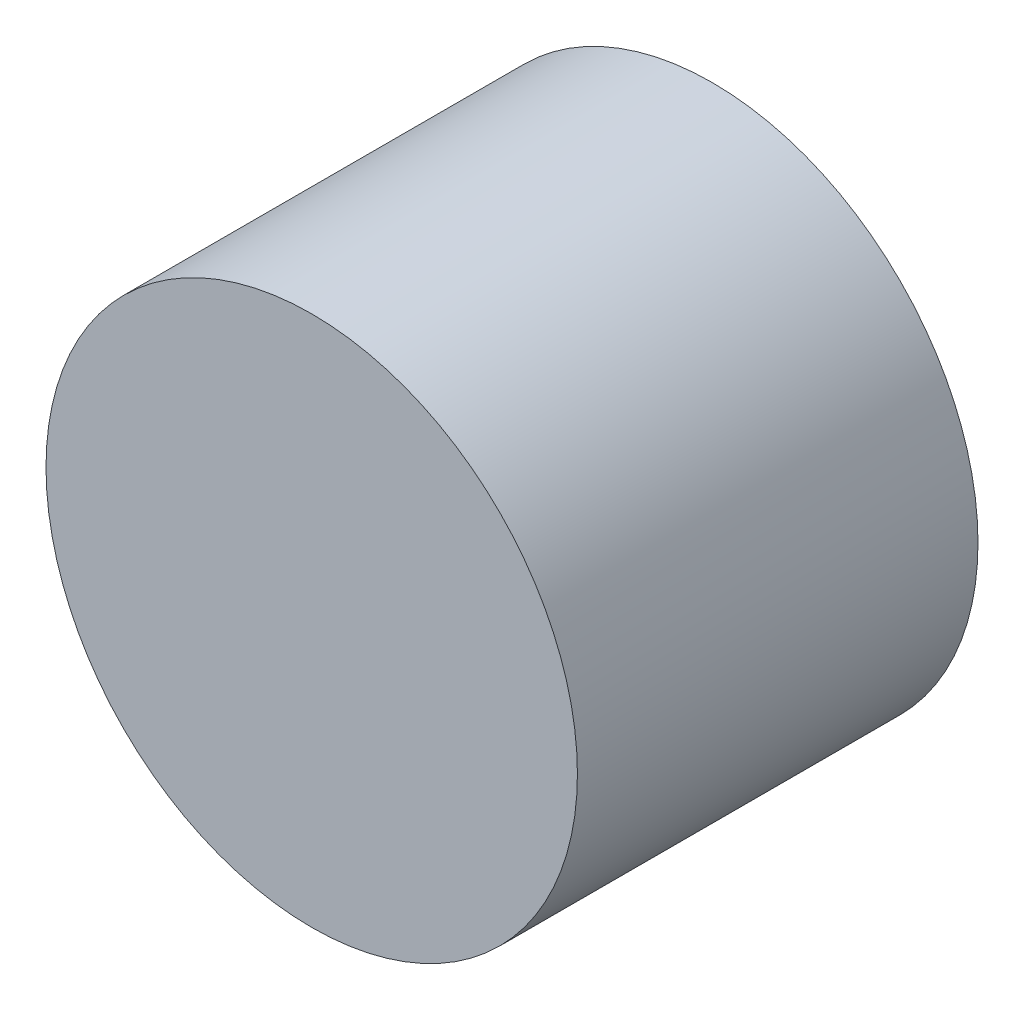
SolidWorks part; units mm, degrees
ref_plane "Plan de face" through (0, 0, 0) normal (0, 0, 1) x (1, 0, 0)
ref_plane "Plan de dessus" through (0, 0, 0) normal (0, 1, 0) x (1, 0, 0)
ref_plane "Plan de droite" through (0, 0, 0) normal (1, 0, 0) x (0, 0, -1)
sketch "Esquisse1" plane through (0, 0, 0) normal (0, 0, 1) x (1, 0, 0)
  circle A0 centre (0, 0) radius 1.99
extrude "Extrusion1" add sketch "Esquisse1" along normal blind 3
